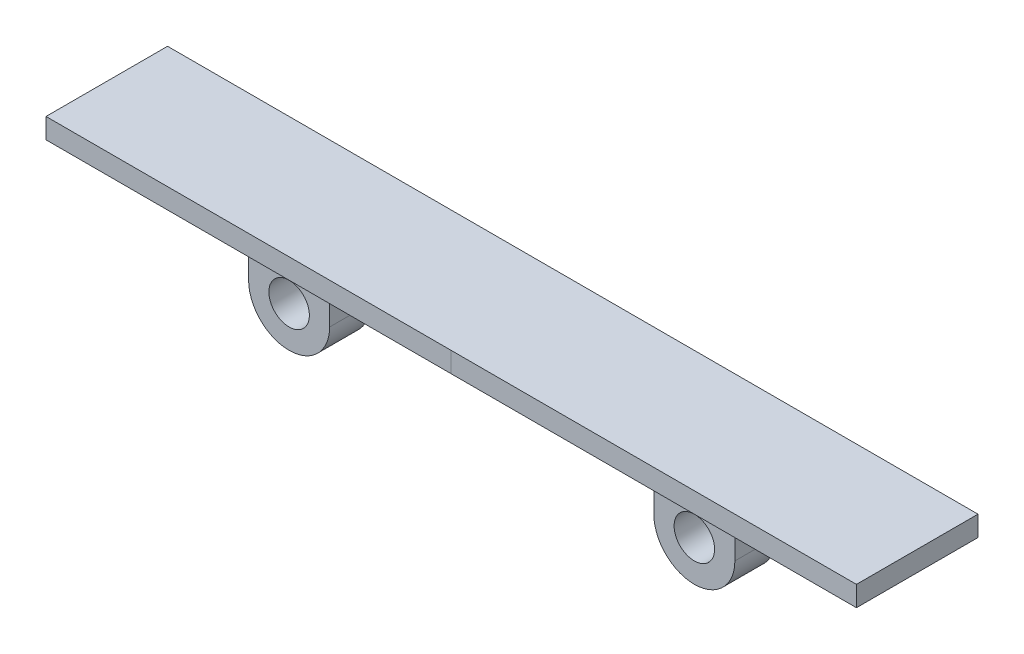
SolidWorks part; units mm, degrees
ref_plane "Front Plane" through (0, 0, 0) normal (0, 0, 1) x (1, 0, 0)
ref_plane "Top Plane" through (0, 0, 0) normal (0, 1, 0) x (1, 0, 0)
ref_plane "Right Plane" through (0, 0, 0) normal (1, 0, 0) x (0, 0, -1)
sketch "Sketch1" plane through (0, 0, 0) normal (0, 1, 0) x (1, 0, 0)
  line L0 (0, 0) -> (0, 95.1694) construction
  line L1 (0, 0) -> (117.2377, 0) construction
  line L3 (-200, 30) -> (200, 30)
  line L4 (-200, 30) -> (-200, -30)
  line L5 (-200, -30) -> (200, -30)
  line L6 (200, 30) -> (200, -30)
  dimension "D1" = 400
  dimension "D2" = 200
  dimension "D3" = 60
  dimension "D4" = 30
extrude "Extrude1" add sketch "Sketch1" against normal blind 10
sketch "Sketch2" plane through (0, -10, 0) normal (0, -1, 0) x (1, 0, 0)
  line L0 (0, 0) -> (-219.0879, 0) construction
  line L1 (-100, 10) -> (-100, -10) construction
  line L2 (-120, -10) -> (-80, -10)
  line L3 (-120, -10) -> (-120, 10)
  line L4 (-120, 10) -> (-80, 10)
  line L5 (-80, -10) -> (-80, 10)
  line L6 (0, 0) -> (0, -104.2356) construction
  dimension "D1" = 40
  dimension "D2" = 20
  dimension "D3" = 20
  dimension "D4" = 10
  dimension "D5" = 200
extrude "Extrude2" add sketch "Sketch2" along normal blind 50
fillet "Fillet1" radius 20 2 edges at (-80, -60, 0) (-120, -60, 0)
sketch "Sketch3" plane through (0, 0, -10) normal (0, 0, -1) x (1, 0, 0)
  circle A0 centre (-100, 40) radius 10
  arc A1 (-100, 60) -> (-120, 40) centre (-100, 40) ccw construction
  dimension "D1" = 20
extrude "Cut-Extrude1" cut sketch "Sketch3" against normal through all
fillet "Fillet2" radius 5 2 edges at (-120, -10, 0) (-80, -10, 0)
mirror "Mirror1" about plane through (0, 0, 0) normal (1, 0, 0) of "Fillet2", "Extrude2", "Fillet1", "Cut-Extrude1"
sketch "Sketch4" plane through (0, 0, 0) normal (0, 1, 0) x (-1, 0, 0)
  line L0 (0, -30) -> (0, 30)
  line L1 (-200, -30) -> (200, -30) construction
  line L2 (200, 30) -> (-200, 30) construction
equation "\"D2@Sketch1\" = \"D1@Sketch1\"/2"
equation "\"D4@Sketch1\" = \"D3@Sketch1\"/2"
equation "\"D2@Sketch2\" = \"D1@Sketch2\"/2"
